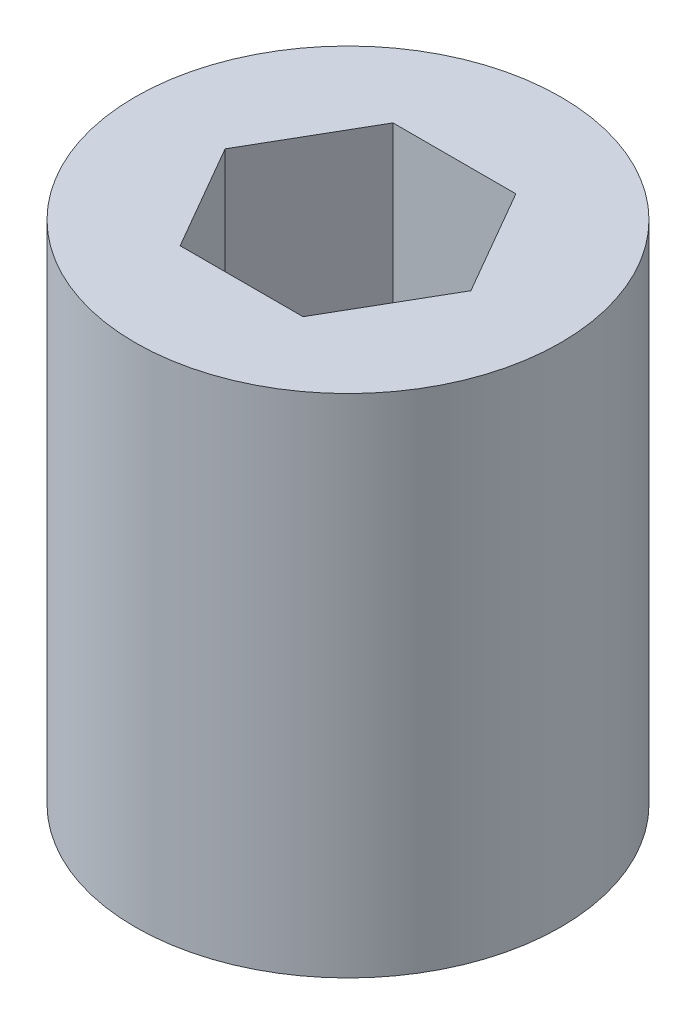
SolidWorks part; units mm, degrees
ref_plane "Front" through (0, 0, 0) normal (0, 0, 1) x (1, 0, 0)
ref_plane "Top" through (0, 0, 0) normal (0, 1, 0) x (1, 0, 0)
ref_plane "Right" through (0, 0, 0) normal (1, 0, 0) x (0, 0, -1)
other "Configuration Table"
sketch "profile" plane through (0, 0, 0) normal (0, 0, 1) x (1, 0, 0)
  line L0 (0, 9.9072) -> (0, -20.7151) construction
  line L1 (1.5, -3.567) -> (0.75, -4)
  line L2 (0.75, -4) -> (0, -3.567)
  line L3 (0, 0) -> (1.5, 0)
  line L4 (1.5, 0) -> (1.5, -3.567)
  line L6 (0, -3.567) -> (0, 0)
  point P12 (0.75, 0)
  dimension "D1" = 60
  dimension "diameter" = 3
  dimension "length" = 4
revolve "Base-Revolve" add sketch "profile" angle 360 about L0
sketch "socket" plane through (0, 0, 0) normal (0, 1, 0) x (-1, 0, 0)
  line L0 (0, 0) -> (0.866, 0) construction
  line L1 (0, 0) -> (0.433, 0.75) construction
  line L2 (0.866, 0) -> (0.433, 0.75)
  line L3 (0.866, 0) -> (0.433, -0.75)
  line L4 (-0.433, -0.75) -> (0.433, -0.75)
  line L5 (-0.433, -0.75) -> (-0.866, 0)
  line L6 (-0.433, 0.75) -> (-0.866, 0)
  line L7 (-0.433, 0.75) -> (0.433, 0.75)
  dimension "D1" = 60
  dimension "drive_size" = 1.5
extrude "drive socket" cut sketch "socket" against normal blind 1.5
